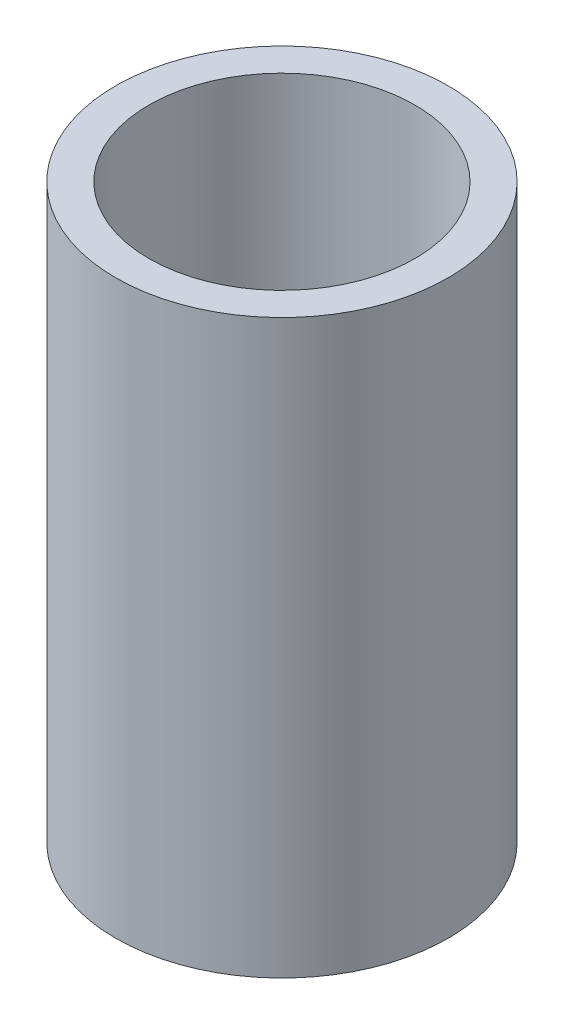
SolidWorks part; units mm, degrees
ref_plane "Plan de face" through (0, 0, 0) normal (0, 0, 1) x (1, 0, 0)
ref_plane "Plan de dessus" through (0, 0, 0) normal (0, 1, 0) x (1, 0, 0)
ref_plane "Plan de droite" through (0, 0, 0) normal (1, 0, 0) x (0, 0, -1)
sketch "Esquisse1" plane through (0, 0, 0) normal (0, 1, 0) x (1, 0, 0)
  circle A0 centre (0, 0) radius 12.5
  circle A1 centre (0, 0) radius 10
  dimension "D1" = 25
  dimension "D2" = 20
extrude "Extrusion1" add sketch "Esquisse1" against normal blind 43
